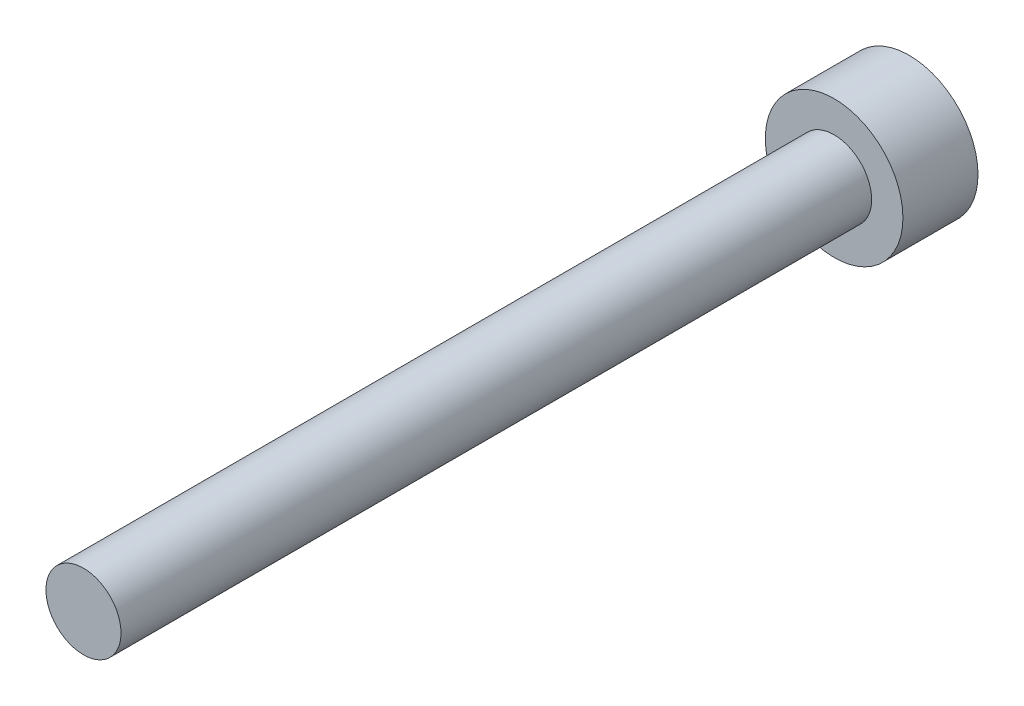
SolidWorks part; units mm, degrees
ref_plane "前视基准面" through (0, 0, 0) normal (0, 0, 1) x (1, 0, 0)
ref_plane "上视基准面" through (0, 0, 0) normal (0, 1, 0) x (1, 0, 0)
ref_plane "右视基准面" through (0, 0, 0) normal (1, 0, 0) x (0, 0, -1)
other "Configuration Table"
sketch "草图1" plane through (0, 0, 0) normal (0, 0, 1) x (1, 0, 0)
  circle A0 centre (0, 0) radius 2.75
  dimension "D1" = 5.5
extrude "Head_envelope" add sketch "草图1" along normal blind 3 from offset 3
sketch "草图2" plane through (0, 0, 0) normal (0, 0, 1) x (1, 0, 0)
  circle A0 centre (0, 0) radius 1.5
  dimension "D1" = 3
extrude "Shank_envelope_no_threads" add sketch "草图2" along normal blind 30
